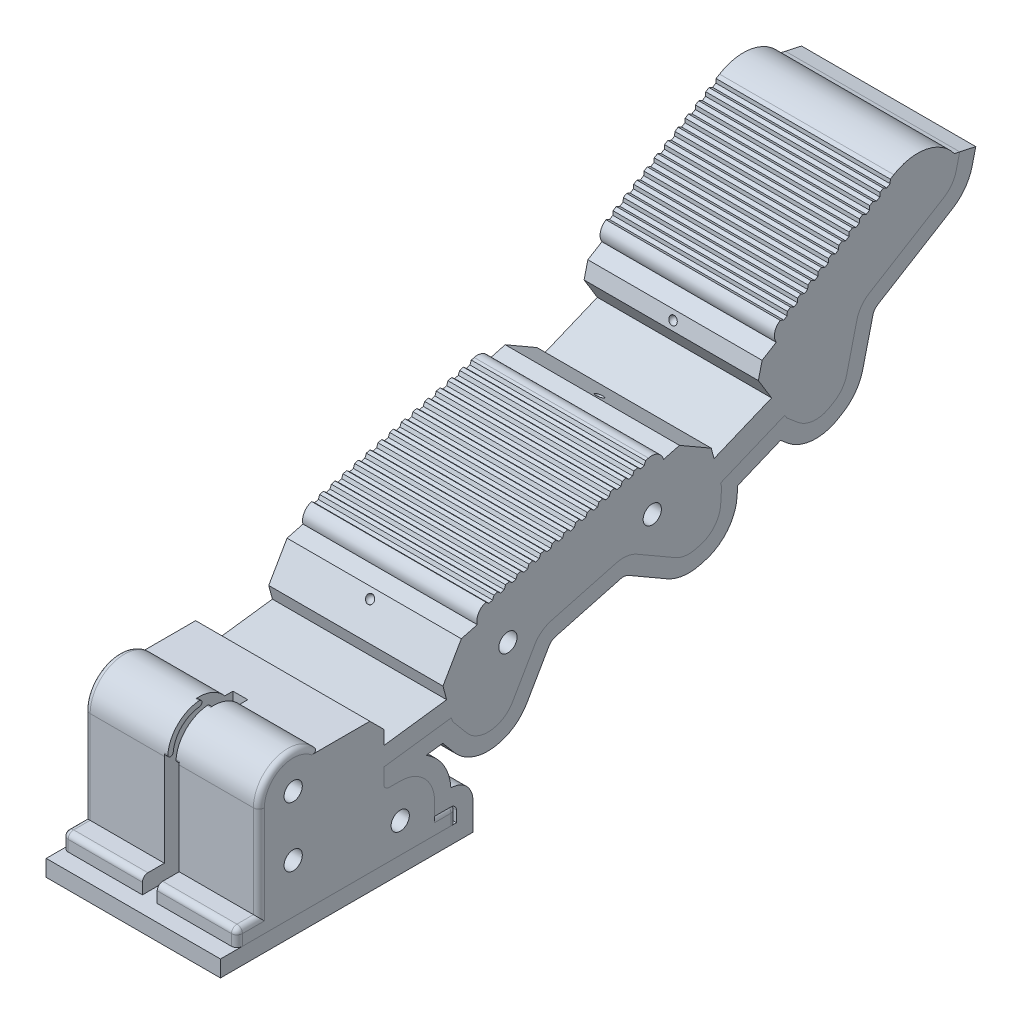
SolidWorks part; units mm, degrees
other "<shell_ff>-<Union>"
other "<shell_ff>-<Contouring>"
ref_plane "Front Plane" through (0, 0, 0) normal (0, 0, 1) x (1, 0, 0)
ref_plane "Top Plane" through (0, 0, 0) normal (0, 1, 0) x (1, 0, 0)
ref_plane "Right Plane" through (0, 0, 0) normal (1, 0, 0) x (0, 0, -1)
inserted part "shell_ff"
sketch "Sketch1" plane through (15.875, 0, 0) normal (1, 0, 0) x (0, 0, -1)
  line L1 (116.3122, 42.9188) -> (119.2429, 42.2748)
  line L2 (-15.375, -17.1005) -> (-18.375, -17.1005)
  line L35 (102.741, 47.8696) -> (82.0558, 35.2325)
  line L36 (79.5522, 31.0663) -> (77.6883, 29.9276)
  line L37 (77.6883, 29.9276) -> (76.4172, 24.6646)
  line L38 (76.4172, 24.6646) -> (77.6453, 22.6543)
  line L39 (77.6453, 22.6543) -> (73.3989, 20.8954)
  line L40 (73.3989, 20.8954) -> (65.6791, 25.3525)
  line L41 (65.6791, 25.3525) -> (63.5693, 24.7872)
  line L42 (58.8253, 25.8454) -> (29.2214, 17.9131)
  line L43 (25.6421, 14.6246) -> (23.5324, 14.0593)
  line L44 (23.5324, 14.0593) -> (18.9471, 6.1173)
  line L45 (18.9471, 6.1173) -> (19.0506, 5.7309)
  line L46 (19.0506, 5.7309) -> (14.375, 5.1153)
  line L47 (14.375, 5.1153) -> (14.375, 5.5154)
  line L48 (14.375, 5.5154) -> (10.0904, 9.8)
  line L49 (10.0904, 9.8) -> (0.8633, 9.8)
  line L50 (-14.375, 2.75) -> (-14.375, -11.1005)
  line L51 (-18.375, -15.1005) -> (-18.375, -20.1005)
  line L52 (-18.375, -20.1005) -> (27.625, -20.1005)
  line L53 (27.625, -20.1005) -> (27.625, -15.1005)
  line L54 (23.625, -11.1005) -> (23.6086, -11.1005)
  line L55 (19.1069, -3.7025) -> (22.1192, -3.3059)
  line L56 (22.1192, -3.3059) -> (24.2215, -5.8151)
  line L57 (32.4243, -8.4048) -> (32.588, -8.3609)
  line L58 (37.4457, -4.6335) -> (41.4617, 2.3225)
  line L59 (42.6761, 3.2543) -> (54.5026, 6.4232)
  line L60 (56.0202, 6.2234) -> (62.9762, 2.2074)
  line L61 (69.0467, 1.4082) -> (69.8414, 1.6211)
  line L62 (75.7557, 8.8571) -> (75.8558, 10.4828)
  line L63 (75.8558, 10.4828) -> (83.6693, 13.7193)
  line L64 (83.6693, 13.7193) -> (84.9456, 12.6437)
  line L65 (94.2716, 11.9344) -> (95.0333, 12.3997)
  line L66 (98.639, 17.3484) -> (100.5002, 25.0546)
  line L67 (101.4017, 26.2918) -> (114.9749, 34.5841)
  line L68 (118.5807, 39.5327) -> (119.2429, 42.2748)
  line L69 (119.2429, 42.2748) -> (116.9789, 45.8438)
  line L70 (102.741, 47.8696) -> (82.0558, 35.2325)
  line L71 (79.5522, 31.0663) -> (77.6883, 29.9276)
  line L72 (77.6883, 29.9276) -> (76.4172, 24.6646)
  line L73 (76.4172, 24.6646) -> (77.6453, 22.6543)
  line L74 (77.6453, 22.6543) -> (73.3989, 20.8954)
  line L75 (73.3989, 20.8954) -> (65.6791, 25.3525)
  line L76 (65.6791, 25.3525) -> (63.5693, 24.7872)
  line L77 (58.8253, 25.8454) -> (29.2214, 17.9131)
  line L78 (25.6421, 14.6246) -> (23.5324, 14.0593)
  line L79 (23.5324, 14.0593) -> (18.9471, 6.1173)
  line L80 (18.9471, 6.1173) -> (19.0506, 5.7309)
  line L81 (19.0506, 5.7309) -> (14.375, 5.1153)
  line L82 (14.375, 5.1153) -> (14.375, 5.5154)
  line L83 (14.375, 5.5154) -> (10.0904, 9.8)
  line L84 (10.0904, 9.8) -> (0.8633, 9.8)
  line L85 (-14.375, 2.75) -> (-14.375, -11.1005)
  line L86 (-18.375, -15.1005) -> (-18.375, -20.1005)
  line L87 (-18.375, -20.1005) -> (27.625, -20.1005)
  line L88 (27.625, -20.1005) -> (27.625, -15.1005)
  line L89 (23.625, -11.1005) -> (23.6086, -11.1005)
  line L90 (19.1069, -3.7025) -> (22.1192, -3.3059)
  line L91 (22.1192, -3.3059) -> (24.2215, -5.8151)
  line L92 (32.4243, -8.4048) -> (32.588, -8.3609)
  line L93 (37.4457, -4.6335) -> (41.4617, 2.3225)
  line L94 (42.6761, 3.2543) -> (54.5026, 6.4232)
  line L95 (56.0202, 6.2234) -> (62.9762, 2.2074)
  line L96 (69.0467, 1.4082) -> (69.8414, 1.6211)
  line L97 (75.7557, 8.8571) -> (75.8558, 10.4828)
  line L98 (75.8558, 10.4828) -> (83.6693, 13.7193)
  line L99 (83.6693, 13.7193) -> (84.9456, 12.6437)
  line L100 (94.2716, 11.9344) -> (95.0333, 12.3997)
  line L101 (98.639, 17.3484) -> (100.5002, 25.0546)
  line L102 (101.4017, 26.2918) -> (114.9749, 34.5841)
  line L103 (118.5807, 39.5327) -> (119.2429, 42.2748)
  line L104 (119.2429, 42.2748) -> (116.9789, 45.8438)
  line L212 (11.375, -4.4005) -> (11.375, -1.6945)
  line L213 (14.375, -5.4005) -> (12.375, -5.4005)
  line L214 (20.625, -14.1005) -> (20.625, -11.6505)
  line L215 (23.625, -14.1005) -> (20.625, -14.1005)
  line L216 (24.625, -17.1005) -> (24.625, -15.1005)
  line L217 (-15.375, -17.1005) -> (24.625, -17.1005)
  line L218 (-15.375, -15.1005) -> (-15.375, -17.1005)
  line L219 (-11.375, -14.1005) -> (-14.375, -14.1005)
  line L220 (-11.375, 2.75) -> (-11.375, -14.1005)
  line L221 (8.8478, 6.8) -> (-0.3647, 6.8)
  line L222 (11.375, 4.2728) -> (8.8478, 6.8)
  line L223 (11.375, 1.6945) -> (11.375, 4.2728)
  line L224 (22.8338, 3.2031) -> (11.375, 1.6945)
  line L225 (22.1665, 5.6935) -> (22.8338, 3.2031)
  line L226 (25.5091, 11.4831) -> (22.1665, 5.6935)
  line L227 (28.4069, 12.2596) -> (25.5091, 11.4831)
  line L228 (30.5329, 14.5639) -> (29.9979, 15.0153)
  line L229 (31.2091, 14.7451) -> (30.5329, 14.5639)
  line L230 (31.4468, 15.4035) -> (31.2091, 14.7451)
  line L231 (32.1229, 15.5847) -> (31.4468, 15.4035)
  line L232 (32.658, 15.1333) -> (32.1229, 15.5847)
  line L233 (33.3341, 15.3145) -> (32.658, 15.1333)
  line L234 (33.5718, 15.9729) -> (33.3341, 15.3145)
  line L235 (34.248, 16.1541) -> (33.5718, 15.9729)
  line L236 (34.783, 15.7027) -> (34.248, 16.1541)
  line L237 (35.4592, 15.8839) -> (34.783, 15.7027)
  line L238 (35.6968, 16.5423) -> (35.4592, 15.8839)
  line L239 (36.373, 16.7235) -> (35.6968, 16.5423)
  line L240 (36.908, 16.2721) -> (36.373, 16.7235)
  line L241 (37.5842, 16.4533) -> (36.908, 16.2721)
  line L242 (37.8219, 17.1117) -> (37.5842, 16.4533)
  line L243 (38.498, 17.2929) -> (37.8219, 17.1117)
  line L244 (39.0331, 16.8415) -> (38.498, 17.2929)
  line L245 (39.7092, 17.0227) -> (39.0331, 16.8415)
  line L246 (39.9469, 17.6811) -> (39.7092, 17.0227)
  line L247 (40.6231, 17.8623) -> (39.9469, 17.6811)
  line L248 (41.1581, 17.4109) -> (40.6231, 17.8623)
  line L249 (41.8343, 17.5921) -> (41.1581, 17.4109)
  line L250 (42.072, 18.2505) -> (41.8343, 17.5921)
  line L251 (42.7481, 18.4317) -> (42.072, 18.2505)
  line L252 (43.2832, 17.9803) -> (42.7481, 18.4317)
  line L253 (43.9593, 18.1615) -> (43.2832, 17.9803)
  line L254 (44.197, 18.8199) -> (43.9593, 18.1615)
  line L255 (44.8731, 19.0011) -> (44.197, 18.8199)
  line L256 (45.4082, 18.5497) -> (44.8731, 19.0011)
  line L257 (46.0843, 18.7309) -> (45.4082, 18.5497)
  line L258 (46.322, 19.3893) -> (46.0843, 18.7309)
  line L259 (46.9982, 19.5705) -> (46.322, 19.3893)
  line L260 (47.5332, 19.1191) -> (46.9982, 19.5705)
  line L261 (48.2094, 19.3003) -> (47.5332, 19.1191)
  line L262 (48.4471, 19.9587) -> (48.2094, 19.3003)
  line L263 (49.1232, 20.1399) -> (48.4471, 19.9587)
  line L264 (49.6583, 19.6885) -> (49.1232, 20.1399)
  line L265 (50.3344, 19.8697) -> (49.6583, 19.6885)
  line L266 (50.5721, 20.5281) -> (50.3344, 19.8697)
  line L267 (51.2482, 20.7093) -> (50.5721, 20.5281)
  line L268 (51.7833, 20.2579) -> (51.2482, 20.7093)
  line L269 (52.4594, 20.4391) -> (51.7833, 20.2579)
  line L270 (52.6971, 21.0975) -> (52.4594, 20.4391)
  line L271 (53.3733, 21.2787) -> (52.6971, 21.0975)
  line L272 (53.9083, 20.8273) -> (53.3733, 21.2787)
  line L273 (54.5845, 21.0085) -> (53.9083, 20.8273)
  line L274 (54.8222, 21.6669) -> (54.5845, 21.0085)
  line L275 (55.4983, 21.8481) -> (54.8222, 21.6669)
  line L276 (56.0334, 21.3967) -> (55.4983, 21.8481)
  line L277 (56.7095, 21.5779) -> (56.0334, 21.3967)
  line L278 (56.9472, 22.2363) -> (56.7095, 21.5779)
  line L279 (57.6234, 22.4175) -> (56.9472, 22.2363)
  line L280 (58.1584, 21.9661) -> (57.6234, 22.4175)
  line L281 (58.8346, 22.1473) -> (58.1584, 21.9661)
  line L282 (59.0722, 22.8057) -> (58.8346, 22.1473)
  line L283 (59.6018, 22.9476) -> (59.0722, 22.8057)
  line L284 (65.2552, 22.1331) -> (62.3575, 21.3566)
  line L285 (71.0449, 18.7904) -> (65.2552, 22.1331)
  line L286 (71.5555, 16.8847) -> (71.0449, 18.7904)
  line L287 (82.034, 21.225) -> (71.5555, 16.8847)
  line L288 (79.6251, 25.1682) -> (82.034, 21.225)
  line L289 (80.3127, 28.0154) -> (79.6251, 25.1682)
  line L290 (82.8728, 29.5794) -> (80.3127, 28.0154)
  line L291 (84.2607, 32.3908) -> (83.6198, 32.6725)
  line L292 (84.858, 32.7557) -> (84.2607, 32.3908)
  line L293 (84.8999, 33.4545) -> (84.858, 32.7557)
  line L294 (85.4972, 33.8194) -> (84.8999, 33.4545)
  line L295 (86.138, 33.5377) -> (85.4972, 33.8194)
  line L296 (86.7354, 33.9026) -> (86.138, 33.5377)
  line L297 (86.7772, 34.6014) -> (86.7354, 33.9026)
  line L298 (87.3746, 34.9663) -> (86.7772, 34.6014)
  line L299 (88.0154, 34.6846) -> (87.3746, 34.9663)
  line L300 (88.6128, 35.0496) -> (88.0154, 34.6846)
  line L301 (88.6546, 35.7483) -> (88.6128, 35.0496)
  line L302 (89.252, 36.1133) -> (88.6546, 35.7483)
  line L303 (89.8928, 35.8316) -> (89.252, 36.1133)
  line L304 (90.4901, 36.1965) -> (89.8928, 35.8316)
  line L305 (90.532, 36.8953) -> (90.4901, 36.1965)
  line L306 (91.1293, 37.2602) -> (90.532, 36.8953)
  line L307 (91.7702, 36.9785) -> (91.1293, 37.2602)
  line L308 (92.3675, 37.3435) -> (91.7702, 36.9785)
  line L309 (92.4094, 38.0422) -> (92.3675, 37.3435)
  line L310 (93.0067, 38.4071) -> (92.4094, 38.0422)
  line L311 (93.6475, 38.1255) -> (93.0067, 38.4071)
  line L312 (94.2449, 38.4904) -> (93.6475, 38.1255)
  line L313 (94.2867, 39.1891) -> (94.2449, 38.4904)
  line L314 (94.8841, 39.5541) -> (94.2867, 39.1891)
  line L315 (95.5249, 39.2724) -> (94.8841, 39.5541)
  line L316 (96.1222, 39.6373) -> (95.5249, 39.2724)
  line L317 (96.1641, 40.3361) -> (96.1222, 39.6373)
  line L318 (96.7615, 40.701) -> (96.1641, 40.3361)
  line L319 (97.4023, 40.4193) -> (96.7615, 40.701)
  line L320 (97.9996, 40.7843) -> (97.4023, 40.4193)
  line L321 (98.0415, 41.483) -> (97.9996, 40.7843)
  line L322 (98.6388, 41.848) -> (98.0415, 41.483)
  line L323 (99.2796, 41.5663) -> (98.6388, 41.848)
  line L324 (99.877, 41.9312) -> (99.2796, 41.5663)
  line L325 (99.9189, 42.63) -> (99.877, 41.9312)
  line L326 (100.5162, 42.9949) -> (99.9189, 42.63)
  line L327 (101.157, 42.7132) -> (100.5162, 42.9949)
  line L328 (101.7544, 43.0782) -> (101.157, 42.7132)
  line L329 (101.7962, 43.7769) -> (101.7544, 43.0782)
  line L330 (102.3936, 44.1418) -> (101.7962, 43.7769)
  line L331 (103.0344, 43.8602) -> (102.3936, 44.1418)
  line L332 (103.6317, 44.2251) -> (103.0344, 43.8602)
  line L333 (103.6736, 44.9238) -> (103.6317, 44.2251)
  line L334 (104.305, 45.3096) -> (103.6736, 44.9238)
  line L335 (116.3122, 42.9188) -> (115.3247, 43.1358)
  line L336 (115.6645, 40.237) -> (116.3122, 42.9188)
  line L337 (99.8376, 28.8518) -> (113.4109, 37.1441)
  line L338 (95.7229, 18.0527) -> (97.5841, 25.7589)
  line L339 (92.7076, 14.4944) -> (93.4693, 14.9598)
  line L340 (84.81, 16.6812) -> (86.8789, 14.9378)
  line L341 (84.4406, 17.2859) -> (84.81, 16.6812)
  line L342 (72.746, 12.4418) -> (84.4406, 17.2859)
  line L343 (72.9287, 11.7598) -> (72.746, 12.4418)
  line L344 (72.7614, 9.0414) -> (72.9287, 11.7598)
  line L345 (68.2703, 4.306) -> (69.0649, 4.5189)
  line L346 (57.5202, 8.8215) -> (64.4762, 4.8055)
  line L347 (41.8997, 6.1521) -> (53.7261, 9.321)
  line L348 (34.8476, -3.1335) -> (38.8636, 3.8225)
  line L349 (31.6478, -5.507) -> (31.8116, -5.4631)
  line L350 (23.8936, -0.7524) -> (26.5211, -3.8884)
  line L351 (23.7109, -0.0704) -> (23.8936, -0.7524)
  line L352 (11.375, -1.6945) -> (23.7109, -0.0704)
  line L353 (11.375, -4.4005) -> (11.375, -1.6945)
  line L354 (14.375, -5.4005) -> (12.375, -5.4005)
  line L355 (20.625, -14.1005) -> (20.625, -11.6505)
  line L356 (23.625, -14.1005) -> (20.625, -14.1005)
  line L357 (24.625, -17.1005) -> (24.625, -15.1005)
  line L358 (-15.375, -17.1005) -> (24.625, -17.1005)
  line L359 (-15.375, -15.1005) -> (-15.375, -17.1005)
  line L360 (-11.375, -14.1005) -> (-14.375, -14.1005)
  line L361 (-11.375, 2.75) -> (-11.375, -14.1005)
  line L362 (8.8478, 6.8) -> (-0.3647, 6.8)
  line L363 (11.375, 4.2728) -> (8.8478, 6.8)
  line L364 (11.375, 1.6945) -> (11.375, 4.2728)
  line L365 (22.8338, 3.2031) -> (11.375, 1.6945)
  line L366 (22.1665, 5.6935) -> (22.8338, 3.2031)
  line L367 (25.5091, 11.4831) -> (22.1665, 5.6935)
  line L368 (28.4069, 12.2596) -> (25.5091, 11.4831)
  line L369 (30.5329, 14.5639) -> (29.9979, 15.0153)
  line L370 (31.2091, 14.7451) -> (30.5329, 14.5639)
  line L371 (31.4468, 15.4035) -> (31.2091, 14.7451)
  line L372 (32.1229, 15.5847) -> (31.4468, 15.4035)
  line L373 (32.658, 15.1333) -> (32.1229, 15.5847)
  line L374 (33.3341, 15.3145) -> (32.658, 15.1333)
  line L375 (33.5718, 15.9729) -> (33.3341, 15.3145)
  line L376 (34.248, 16.1541) -> (33.5718, 15.9729)
  line L377 (34.783, 15.7027) -> (34.248, 16.1541)
  line L378 (35.4592, 15.8839) -> (34.783, 15.7027)
  line L379 (35.6968, 16.5423) -> (35.4592, 15.8839)
  line L380 (36.373, 16.7235) -> (35.6968, 16.5423)
  line L381 (36.908, 16.2721) -> (36.373, 16.7235)
  line L382 (37.5842, 16.4533) -> (36.908, 16.2721)
  line L383 (37.8219, 17.1117) -> (37.5842, 16.4533)
  line L384 (38.498, 17.2929) -> (37.8219, 17.1117)
  line L385 (39.0331, 16.8415) -> (38.498, 17.2929)
  line L386 (39.7092, 17.0227) -> (39.0331, 16.8415)
  line L387 (39.9469, 17.6811) -> (39.7092, 17.0227)
  line L388 (40.6231, 17.8623) -> (39.9469, 17.6811)
  line L389 (41.1581, 17.4109) -> (40.6231, 17.8623)
  line L390 (41.8343, 17.5921) -> (41.1581, 17.4109)
  line L391 (42.072, 18.2505) -> (41.8343, 17.5921)
  line L392 (42.7481, 18.4317) -> (42.072, 18.2505)
  line L393 (43.2832, 17.9803) -> (42.7481, 18.4317)
  line L394 (43.9593, 18.1615) -> (43.2832, 17.9803)
  line L395 (44.197, 18.8199) -> (43.9593, 18.1615)
  line L396 (44.8731, 19.0011) -> (44.197, 18.8199)
  line L397 (45.4082, 18.5497) -> (44.8731, 19.0011)
  line L398 (46.0843, 18.7309) -> (45.4082, 18.5497)
  line L399 (46.322, 19.3893) -> (46.0843, 18.7309)
  line L400 (46.9982, 19.5705) -> (46.322, 19.3893)
  line L401 (47.5332, 19.1191) -> (46.9982, 19.5705)
  line L402 (48.2094, 19.3003) -> (47.5332, 19.1191)
  line L403 (48.4471, 19.9587) -> (48.2094, 19.3003)
  line L404 (49.1232, 20.1399) -> (48.4471, 19.9587)
  line L405 (49.6583, 19.6885) -> (49.1232, 20.1399)
  line L406 (50.3344, 19.8697) -> (49.6583, 19.6885)
  line L407 (50.5721, 20.5281) -> (50.3344, 19.8697)
  line L408 (51.2482, 20.7093) -> (50.5721, 20.5281)
  line L409 (51.7833, 20.2579) -> (51.2482, 20.7093)
  line L410 (52.4594, 20.4391) -> (51.7833, 20.2579)
  line L411 (52.6971, 21.0975) -> (52.4594, 20.4391)
  line L412 (53.3733, 21.2787) -> (52.6971, 21.0975)
  line L413 (53.9083, 20.8273) -> (53.3733, 21.2787)
  line L414 (54.5845, 21.0085) -> (53.9083, 20.8273)
  line L415 (54.8222, 21.6669) -> (54.5845, 21.0085)
  line L416 (55.4983, 21.8481) -> (54.8222, 21.6669)
  line L417 (56.0334, 21.3967) -> (55.4983, 21.8481)
  line L418 (56.7095, 21.5779) -> (56.0334, 21.3967)
  line L419 (56.9472, 22.2363) -> (56.7095, 21.5779)
  line L420 (57.6234, 22.4175) -> (56.9472, 22.2363)
  line L421 (58.1584, 21.9661) -> (57.6234, 22.4175)
  line L422 (58.8346, 22.1473) -> (58.1584, 21.9661)
  line L423 (59.0722, 22.8057) -> (58.8346, 22.1473)
  line L424 (59.6018, 22.9476) -> (59.0722, 22.8057)
  line L425 (65.2552, 22.1331) -> (62.3575, 21.3566)
  line L426 (71.0449, 18.7904) -> (65.2552, 22.1331)
  line L427 (71.5555, 16.8847) -> (71.0449, 18.7904)
  line L428 (82.034, 21.225) -> (71.5555, 16.8847)
  line L429 (79.6251, 25.1682) -> (82.034, 21.225)
  line L430 (80.3127, 28.0154) -> (79.6251, 25.1682)
  line L431 (82.8728, 29.5794) -> (80.3127, 28.0154)
  line L432 (84.2607, 32.3908) -> (83.6198, 32.6725)
  line L433 (84.858, 32.7557) -> (84.2607, 32.3908)
  line L434 (84.8999, 33.4545) -> (84.858, 32.7557)
  line L435 (85.4972, 33.8194) -> (84.8999, 33.4545)
  line L436 (86.138, 33.5377) -> (85.4972, 33.8194)
  line L437 (86.7354, 33.9026) -> (86.138, 33.5377)
  line L438 (86.7772, 34.6014) -> (86.7354, 33.9026)
  line L439 (87.3746, 34.9663) -> (86.7772, 34.6014)
  line L440 (88.0154, 34.6846) -> (87.3746, 34.9663)
  line L441 (88.6128, 35.0496) -> (88.0154, 34.6846)
  line L442 (88.6546, 35.7483) -> (88.6128, 35.0496)
  line L443 (89.252, 36.1133) -> (88.6546, 35.7483)
  line L444 (89.8928, 35.8316) -> (89.252, 36.1133)
  line L445 (90.4901, 36.1965) -> (89.8928, 35.8316)
  line L446 (90.532, 36.8953) -> (90.4901, 36.1965)
  line L447 (91.1293, 37.2602) -> (90.532, 36.8953)
  line L448 (91.7702, 36.9785) -> (91.1293, 37.2602)
  line L449 (92.3675, 37.3435) -> (91.7702, 36.9785)
  line L450 (92.4094, 38.0422) -> (92.3675, 37.3435)
  line L451 (93.0067, 38.4071) -> (92.4094, 38.0422)
  line L452 (93.6475, 38.1255) -> (93.0067, 38.4071)
  line L453 (94.2449, 38.4904) -> (93.6475, 38.1255)
  line L454 (94.2867, 39.1891) -> (94.2449, 38.4904)
  line L455 (94.8841, 39.5541) -> (94.2867, 39.1891)
  line L456 (95.5249, 39.2724) -> (94.8841, 39.5541)
  line L457 (96.1222, 39.6373) -> (95.5249, 39.2724)
  line L458 (96.1641, 40.3361) -> (96.1222, 39.6373)
  line L459 (96.7615, 40.701) -> (96.1641, 40.3361)
  line L460 (97.4023, 40.4193) -> (96.7615, 40.701)
  line L461 (97.9996, 40.7843) -> (97.4023, 40.4193)
  line L462 (98.0415, 41.483) -> (97.9996, 40.7843)
  line L463 (98.6388, 41.848) -> (98.0415, 41.483)
  line L464 (99.2796, 41.5663) -> (98.6388, 41.848)
  line L465 (99.877, 41.9312) -> (99.2796, 41.5663)
  line L466 (99.9189, 42.63) -> (99.877, 41.9312)
  line L467 (100.5162, 42.9949) -> (99.9189, 42.63)
  line L468 (101.157, 42.7132) -> (100.5162, 42.9949)
  line L469 (101.7544, 43.0782) -> (101.157, 42.7132)
  line L470 (101.7962, 43.7769) -> (101.7544, 43.0782)
  line L471 (102.3936, 44.1418) -> (101.7962, 43.7769)
  line L472 (103.0344, 43.8602) -> (102.3936, 44.1418)
  line L473 (103.6317, 44.2251) -> (103.0344, 43.8602)
  line L474 (103.6736, 44.9238) -> (103.6317, 44.2251)
  line L475 (104.305, 45.3096) -> (103.6736, 44.9238)
  line L476 (116.3122, 42.9188) -> (115.3247, 43.1358)
  line L477 (115.6645, 40.237) -> (116.3122, 42.9188)
  line L478 (99.8376, 28.8518) -> (113.4109, 37.1441)
  line L479 (95.7229, 18.0527) -> (97.5841, 25.7589)
  line L480 (92.7076, 14.4944) -> (93.4693, 14.9598)
  line L481 (84.81, 16.6812) -> (86.8789, 14.9378)
  line L482 (84.4406, 17.2859) -> (84.81, 16.6812)
  line L483 (72.746, 12.4418) -> (84.4406, 17.2859)
  line L484 (72.9287, 11.7598) -> (72.746, 12.4418)
  line L485 (72.7614, 9.0414) -> (72.9287, 11.7598)
  line L486 (68.2703, 4.306) -> (69.0649, 4.5189)
  line L487 (57.5202, 8.8215) -> (64.4762, 4.8055)
  line L488 (41.8997, 6.1521) -> (53.7261, 9.321)
  line L489 (34.8476, -3.1335) -> (38.8636, 3.8225)
  line L490 (31.6478, -5.507) -> (31.8116, -5.4631)
  line L491 (23.8936, -0.7524) -> (26.5211, -3.8884)
  line L492 (23.7109, -0.0704) -> (23.8936, -0.7524)
  line L493 (11.375, -1.6945) -> (23.7109, -0.0704)
  arc A18 (82.0558, 35.2325) -> (79.5522, 31.0663) centre (84.7928, 30.7524) ccw
  arc A19 (63.5693, 24.7872) -> (58.8253, 25.8454) centre (60.1841, 20.7743) ccw
  arc A20 (29.2214, 17.9131) -> (25.6421, 14.6246) centre (30.5802, 12.8419) ccw
  arc A21 (0.8633, 9.8) -> (-14.375, 2.75) centre (-5.125, 2.75) ccw
  arc A22 (-14.375, -11.1005) -> (-18.375, -15.1005) centre (-14.375, -15.1005) ccw
  arc A23 (27.625, -15.1005) -> (23.625, -11.1005) centre (23.625, -15.1005) ccw
  arc A24 (23.6086, -11.1005) -> (19.1069, -3.7025) centre (14.375, -11.6505) ccw
  arc A25 (24.2215, -5.8151) -> (32.4243, -8.4048) centre (30.3537, -0.6773) ccw
  arc A26 (32.588, -8.3609) -> (37.4457, -4.6335) centre (30.5175, -0.6335) ccw
  arc A27 (42.6761, 3.2543) -> (41.4617, 2.3225) centre (43.1937, 1.3225) ccw
  arc A28 (56.0202, 6.2234) -> (54.5026, 6.4232) centre (55.0202, 4.4914) ccw
  arc A29 (62.9762, 2.2074) -> (69.0467, 1.4082) centre (66.9762, 9.1356) ccw
  arc A30 (69.8414, 1.6211) -> (75.7557, 8.8571) centre (67.7708, 9.3485) ccw
  arc A31 (84.9456, 12.6437) -> (94.2716, 11.9344) centre (90.1009, 18.7612) ccw
  arc A32 (95.0333, 12.3997) -> (98.639, 17.3484) centre (90.8626, 19.2265) ccw
  arc A33 (101.4017, 26.2918) -> (100.5002, 25.0546) centre (102.4443, 24.5851) ccw
  arc A34 (114.9749, 34.5841) -> (118.5807, 39.5327) centre (110.8043, 41.4109) ccw
  arc A35 (116.9789, 45.8438) -> (102.741, 47.8696) centre (108.632, 38.2267) ccw
  arc A36 (82.0558, 35.2325) -> (79.5522, 31.0663) centre (84.7928, 30.7524) ccw
  arc A37 (63.5693, 24.7872) -> (58.8253, 25.8454) centre (60.1841, 20.7743) ccw
  arc A38 (29.2214, 17.9131) -> (25.6421, 14.6246) centre (30.5802, 12.8419) ccw
  arc A39 (0.8633, 9.8) -> (-14.375, 2.75) centre (-5.125, 2.75) ccw
  arc A40 (-14.375, -11.1005) -> (-18.375, -15.1005) centre (-14.375, -15.1005) ccw
  arc A41 (27.625, -15.1005) -> (23.625, -11.1005) centre (23.625, -15.1005) ccw
  arc A42 (23.6086, -11.1005) -> (19.1069, -3.7025) centre (14.375, -11.6505) ccw
  arc A43 (24.2215, -5.8151) -> (32.4243, -8.4048) centre (30.3537, -0.6773) ccw
  arc A44 (32.588, -8.3609) -> (37.4457, -4.6335) centre (30.5175, -0.6335) ccw
  arc A45 (42.6761, 3.2543) -> (41.4617, 2.3225) centre (43.1937, 1.3225) ccw
  arc A46 (56.0202, 6.2234) -> (54.5026, 6.4232) centre (55.0202, 4.4914) ccw
  arc A47 (62.9762, 2.2074) -> (69.0467, 1.4082) centre (66.9762, 9.1356) ccw
  arc A48 (69.8414, 1.6211) -> (75.7557, 8.8571) centre (67.7708, 9.3485) ccw
  arc A49 (84.9456, 12.6437) -> (94.2716, 11.9344) centre (90.1009, 18.7612) ccw
  arc A50 (95.0333, 12.3997) -> (98.639, 17.3484) centre (90.8626, 19.2265) ccw
  arc A51 (101.4017, 26.2918) -> (100.5002, 25.0546) centre (102.4443, 24.5851) ccw
  arc A52 (114.9749, 34.5841) -> (118.5807, 39.5327) centre (110.8043, 41.4109) ccw
  arc A53 (116.9789, 45.8438) -> (102.741, 47.8696) centre (108.632, 38.2267) ccw
  arc A55 (11.375, -4.4005) -> (12.375, -5.4005) centre (12.375, -4.4005) ccw
  arc A56 (20.625, -11.6505) -> (14.375, -5.4005) centre (14.375, -11.6505) ccw
  arc A57 (24.625, -15.1005) -> (23.625, -14.1005) centre (23.625, -15.1005) ccw
  arc A58 (-14.375, -14.1005) -> (-15.375, -15.1005) centre (-14.375, -15.1005) ccw
  arc A59 (-0.3647, 6.8) -> (-11.375, 2.75) centre (-5.125, 2.75) ccw
  arc A60 (29.9979, 15.0153) -> (28.4069, 12.2596) centre (30.5802, 12.8419) ccw
  arc A61 (62.3575, 21.3566) -> (59.6018, 22.9476) centre (60.1841, 20.7743) ccw
  arc A62 (83.6198, 32.6725) -> (82.8728, 29.5794) centre (84.7928, 30.7524) ccw
  arc A63 (115.3247, 43.1358) -> (104.305, 45.3096) centre (108.632, 38.2267) ccw
  arc A64 (113.4109, 37.1441) -> (115.6645, 40.237) centre (110.8043, 41.4109) ccw
  arc A65 (99.8376, 28.8518) -> (97.5841, 25.7589) centre (102.4443, 24.5851) ccw
  arc A66 (93.4693, 14.9598) -> (95.7229, 18.0527) centre (90.8626, 19.2265) ccw
  arc A67 (86.8789, 14.9378) -> (92.7076, 14.4944) centre (90.1009, 18.7612) ccw
  arc A68 (69.0649, 4.5189) -> (72.7614, 9.0414) centre (67.7708, 9.3485) ccw
  arc A69 (64.4762, 4.8055) -> (68.2703, 4.306) centre (66.9762, 9.1356) ccw
  arc A70 (57.5202, 8.8215) -> (53.7261, 9.321) centre (55.0202, 4.4914) ccw
  arc A71 (41.8997, 6.1521) -> (38.8636, 3.8225) centre (43.1937, 1.3225) ccw
  arc A72 (31.8116, -5.4631) -> (34.8476, -3.1335) centre (30.5175, -0.6335) ccw
  arc A73 (26.5211, -3.8884) -> (31.6478, -5.507) centre (30.3537, -0.6773) ccw
  arc A74 (11.375, -4.4005) -> (12.375, -5.4005) centre (12.375, -4.4005) ccw
  arc A75 (20.625, -11.6505) -> (14.375, -5.4005) centre (14.375, -11.6505) ccw
  arc A76 (24.625, -15.1005) -> (23.625, -14.1005) centre (23.625, -15.1005) ccw
  arc A77 (-14.375, -14.1005) -> (-15.375, -15.1005) centre (-14.375, -15.1005) ccw
  arc A78 (-0.3647, 6.8) -> (-11.375, 2.75) centre (-5.125, 2.75) ccw
  arc A79 (29.9979, 15.0153) -> (28.4069, 12.2596) centre (30.5802, 12.8419) ccw
  arc A80 (62.3575, 21.3566) -> (59.6018, 22.9476) centre (60.1841, 20.7743) ccw
  arc A81 (83.6198, 32.6725) -> (82.8728, 29.5794) centre (84.7928, 30.7524) ccw
  arc A82 (115.3247, 43.1358) -> (104.305, 45.3096) centre (108.632, 38.2267) ccw
  arc A83 (113.4109, 37.1441) -> (115.6645, 40.237) centre (110.8043, 41.4109) ccw
  arc A84 (99.8376, 28.8518) -> (97.5841, 25.7589) centre (102.4443, 24.5851) ccw
  arc A85 (93.4693, 14.9598) -> (95.7229, 18.0527) centre (90.8626, 19.2265) ccw
  arc A86 (86.8789, 14.9378) -> (92.7076, 14.4944) centre (90.1009, 18.7612) ccw
  arc A87 (69.0649, 4.5189) -> (72.7614, 9.0414) centre (67.7708, 9.3485) ccw
  arc A88 (64.4762, 4.8055) -> (68.2703, 4.306) centre (66.9762, 9.1356) ccw
  arc A89 (57.5202, 8.8215) -> (53.7261, 9.321) centre (55.0202, 4.4914) ccw
  arc A90 (41.8997, 6.1521) -> (38.8636, 3.8225) centre (43.1937, 1.3225) ccw
  arc A91 (31.8116, -5.4631) -> (34.8476, -3.1335) centre (30.5175, -0.6335) ccw
  arc A92 (26.5211, -3.8884) -> (31.6478, -5.507) centre (30.3537, -0.6773) ccw
  dimension "D1" = 0
  dimension "D2" = 0
extrude "Piece Cut" cut sketch "Sketch1" against normal through all contours A82 L476 L1 L104 A53 L70 A36 L71 L72 L73 L74 L75 L76 A37 L77 A38 L78 L79 L80 L81 L82 L83 L84 A39 L85 A40 L86 L2 L359 A77 L360 L361 A78 L362 L363 L364 L365 L366 L367 L368 A79 L369 L370 L371 L372 L373 L374 L375 L376 L377 L378
ref_point "Ref Center"
